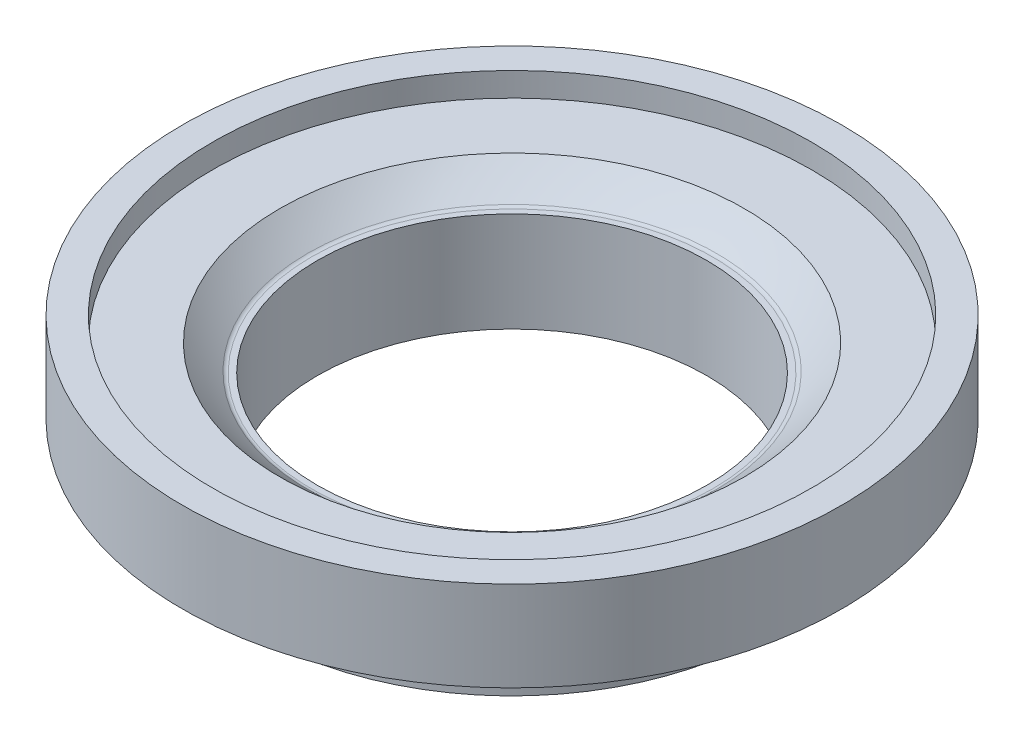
SolidWorks part; units mm, degrees
ref_plane "Face" through (0, 0, 0) normal (0, 0, 1) x (1, 0, 0)
ref_plane "dessus" through (0, 0, 0) normal (0, 1, 0) x (1, 0, 0)
ref_plane "Coté" through (0, 0, 0) normal (1, 0, 0) x (0, 0, -1)
sketch "Esquisse1" plane through (0, 0, 0) normal (0, 0, 1) x (1, 0, 0)
  line L0 (0, 0) -> (0, 12.198) construction
  line L1 (0, 0) -> (13.3724, 0) construction
  line L2 (8.5, 0) -> (8.5, 1)
  line L3 (8.5, 1) -> (9.5, 2)
  line L4 (9.5, 2) -> (11, 2)
  line L5 (8.5, 0) -> (6.5, 0)
  line L6 (11, 2) -> (11, 5)
  line L7 (11, 5) -> (10, 5)
  line L8 (10, 5) -> (10, 4.2)
  line L9 (10, 4.2) -> (6.5, 4.2)
  line L10 (6.5, 0) -> (6.5, 4.2)
  dimension "D1" = 2
  dimension "D2" = 1
  dimension "D3" = 1
  dimension "D4" = 135
  dimension "D5" = 13
  dimension "D6" = 22
  dimension "D7" = 3
  dimension "D8" = 1
  dimension "D9" = 0.8
revolve "Base-Révolution" add sketch "Esquisse1" angle 180 about L0
other "Empreinte tournant sphérique"
other "tournant sphérique<1>@Moule tournant-bague"
sketch "Esquisse2" plane through (0, 0, 0) normal (0, 0, 1) x (1, 0, 0)
  line L0 (-6.7, 3.3295) -> (-6.5, 3.3295)
  line L1 (-6.5, 3.5295) -> (-6.5, 0) construction
  line L2 (-6.5, 3.5295) -> (-6.5, 3.3295)
  line L3 (0, 8.068) -> (0, -1.1298) construction
  line L4 (0, 0) -> (0, 12.198) construction
  arc A0 (-6.8241, 3.3726) -> (-6.5, 3.5295) centre (-6.7, 3.5295) ccw construction
  arc A1 (-6.7, 3.3295) -> (-6.5, 3.5295) centre (-6.7, 3.5295) ccw
revolve "Enlèvement de matière-Révolution1" cut sketch "Esquisse2" angle 180 about L3
mirror "Bossage-Symétrie5" about plane through (-10, 0, 0) normal (0, 0, -1)
